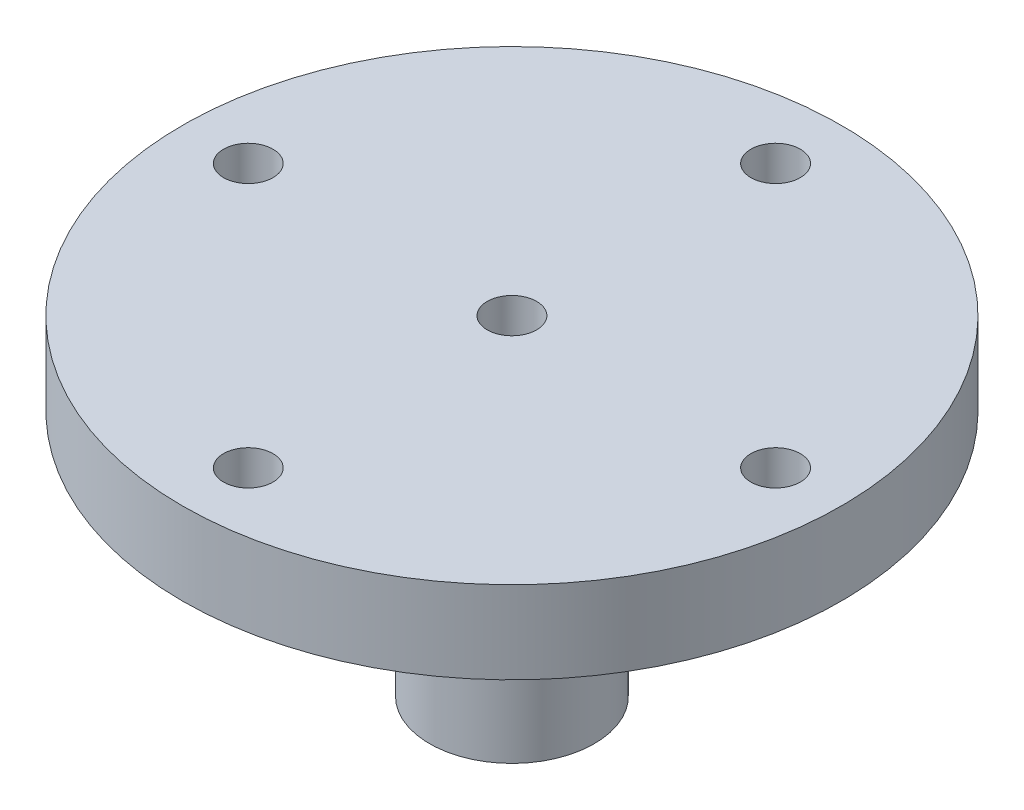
SolidWorks part; units mm, degrees
ref_plane "前视基准面" through (0, 0, 0) normal (0, 0, 1) x (1, 0, 0)
ref_plane "上视基准面" through (0, 0, 0) normal (0, 1, 0) x (1, 0, 0)
ref_plane "右视基准面" through (0, 0, 0) normal (1, 0, 0) x (0, 0, -1)
sketch "草图1" plane through (0, 0, 0) normal (0, 1, 0) x (1, 0, 0)
  circle A0 centre (0, 0) radius 20
  circle A1 centre (0, 0) radius 16 construction
  circle A2 centre (0, -16) radius 1.5
  circle A3 centre (-16, 0) radius 1.5
  circle A4 centre (0, 16) radius 1.5
  circle A5 centre (16, 0) radius 1.5
  point P15 (0, 0)
  dimension "D1" = 4
extrude "凸台-拉伸1" add sketch "草图1" along normal blind 5
sketch "草图2" plane through (0, 0, 0) normal (0, -1, 0) x (1, 0, 0)
  circle A0 centre (0, 0) radius 5
extrude "凸台-拉伸2" add sketch "草图2" along normal blind 15
sketch "草图3" plane through (0, 0, 0) normal (0, -1, 0) x (1, 0, 0)
  circle A0 centre (0, 0) radius 10
extrude "凸台-拉伸3" add sketch "草图3" along normal blind 3
sketch "草图4" plane through (0, -15, 0) normal (0, -1, 0) x (1, 0, 0)
  circle A0 centre (0, 0) radius 1.5
extrude "切除-拉伸1" cut sketch "草图4" against normal up to surface (20 mm away)
